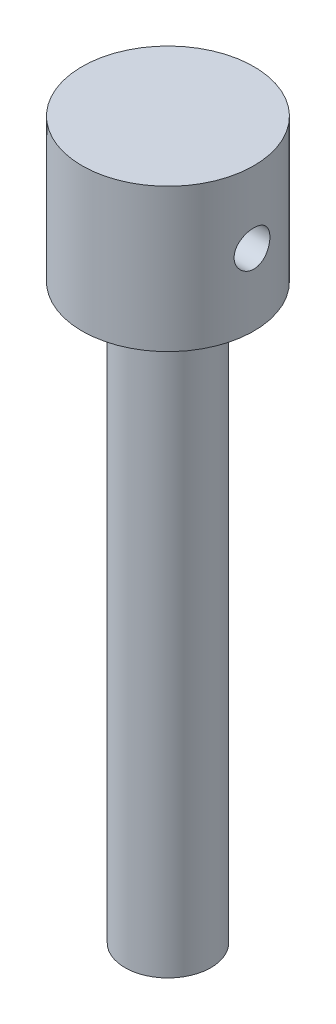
SolidWorks part; units mm, degrees
ref_plane "Front Plane" through (0, 0, 0) normal (0, 0, 1) x (1, 0, 0)
ref_plane "Top Plane" through (0, 0, 0) normal (0, 1, 0) x (1, 0, 0)
ref_plane "Right Plane" through (0, 0, 0) normal (1, 0, 0) x (0, 0, -1)
sketch "Sketch2" plane through (0, 0, 0) normal (0, 1, 0) x (1, 0, 0)
  circle A0 centre (0, 0) radius 12
  dimension "D1" = 24
extrude "Boss-Extrude1" add sketch "Sketch2" against normal blind 20
sketch "Sketch3" plane through (0, -20, 0) normal (0, -1, 0) x (1, 0, 0)
  circle A0 centre (0, 0) radius 6
  dimension "D1" = 12
extrude "Boss-Extrude2" add sketch "Sketch3" along normal blind 80
ref_plane "Plane1" through (12, 0, 0) normal (1, 0, 0) x (0, 0, -1)
sketch "Sketch4" plane through (12, 0, 0) normal (1, 0, 0) x (0, 0, -1)
  line L0 (12, -20) -> (12, 0) construction
  circle A0 centre (0, -10) radius 2.5
  dimension "D1" = 5
  dimension "D2" = 10
  dimension "D3" = 12
extrude "Cut-Extrude1" cut sketch "Sketch4" against normal blind 80
